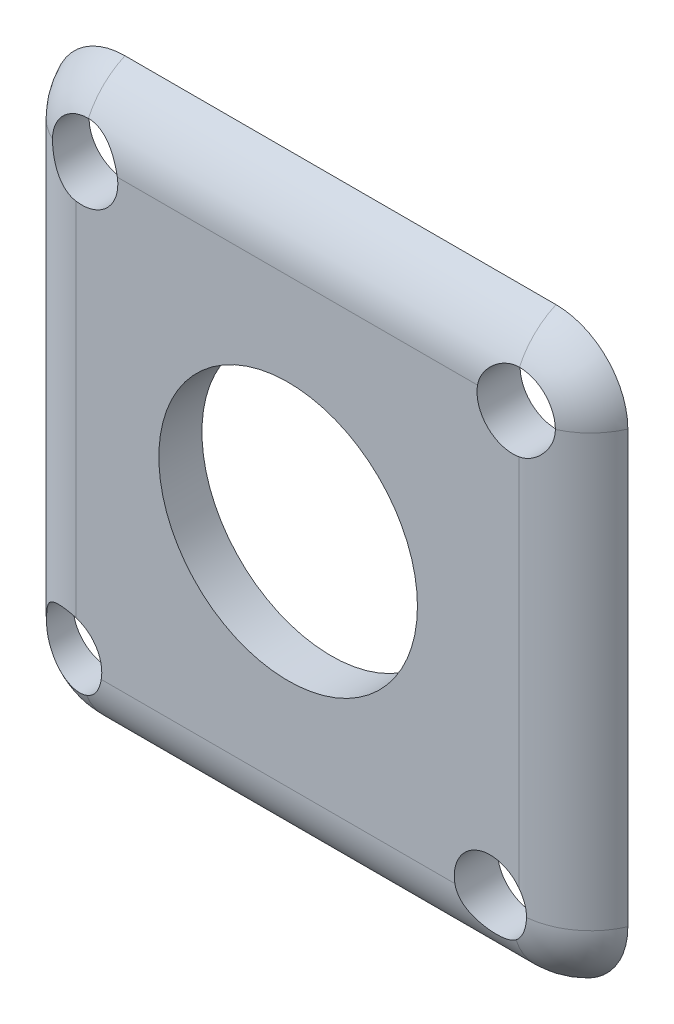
SolidWorks part; units mm, degrees
ref_plane "Plan de face" through (0, 0, 0) normal (0, 0, 1) x (1, 0, 0)
ref_plane "Plan de dessus" through (0, 0, 0) normal (0, 1, 0) x (1, 0, 0)
ref_plane "Plan de droite" through (0, 0, 0) normal (1, 0, 0) x (0, 0, -1)
sketch "Esquisse1" plane through (0, 0, 0) normal (0, 0, 1) x (1, 0, 0)
  line L1 (-7.4024, 6.7123) -> (32.5976, 6.7123)
  line L2 (-7.4024, 6.7123) -> (-7.4024, -33.2877)
  line L3 (-7.4024, -33.2877) -> (32.5976, -33.2877)
  line L4 (32.5976, 6.7123) -> (32.5976, -33.2877)
  point P4 (0, 0)
  point P5 (0, 0)
  dimension "D1" = 40
  dimension "D2" = 40
extrude "Boss.-Extru.1" add sketch "Esquisse1" along normal blind 3
sketch "Esquisse2" plane through (0, 0, 3) normal (0, 0, 1) x (1, 0, 0)
sketch "Esquisse3" plane through (0, 0, 3) normal (0, 0, 1) x (1, 0, 0)
  line L0 (32.5976, -33.2877) -> (32.5976, 6.7123) construction
  line L1 (32.5976, 6.7123) -> (-7.4024, 6.7123) construction
  circle A0 centre (27.5976, 1.7123) radius 2.5
  circle A1 centre (-2.4024, 1.7123) radius 2.5
  circle A2 centre (-3.5187, -28.2669) radius 2.5
  circle A3 centre (26.0154, -28.2459) radius 2.5
  dimension "D3" = 5
  dimension "D1" = 5
  dimension "D2" = 5
  dimension "D4" = 2
  dimension "D5" = 2
  dimension "D6" = 2
extrude "Enlèv. mat.-Extru.1" cut sketch "Esquisse3" against normal through all
fillet "Congé2" radius 5 1 edges at (32.5976, 6.7123, 1.5)
fillet "Congé3" radius 5 1 edges at (32.5976, -33.2877, 1.5)
fillet "Congé4" radius 5 1 edges at (-7.4024, -33.2877, 1.5)
fillet "Congé5" radius 5 1 edges at (-7.4024, 6.7123, 1.5)
fillet "Congé6" radius 5 4 edges at (32.5976, -13.2877, 3) (12.5976, -33.2877, 3) (-7.4024, -13.2877, 3) (12.5976, 6.7123, 3)
sketch "Esquisse4" plane through (0, 0, 3) normal (0, 0, 1) x (1, 0, 0)
  line L0 (-2.4024, -33.2877) -> (27.5976, -33.2877) construction
  circle A0 centre (11.9528, -13.2877) radius 9
  point P4 (0, 0)
  dimension "D2" = 18
  dimension "D1" = 20
extrude "Enlèv. mat.-Extru.2" cut sketch "Esquisse4" against normal through all
